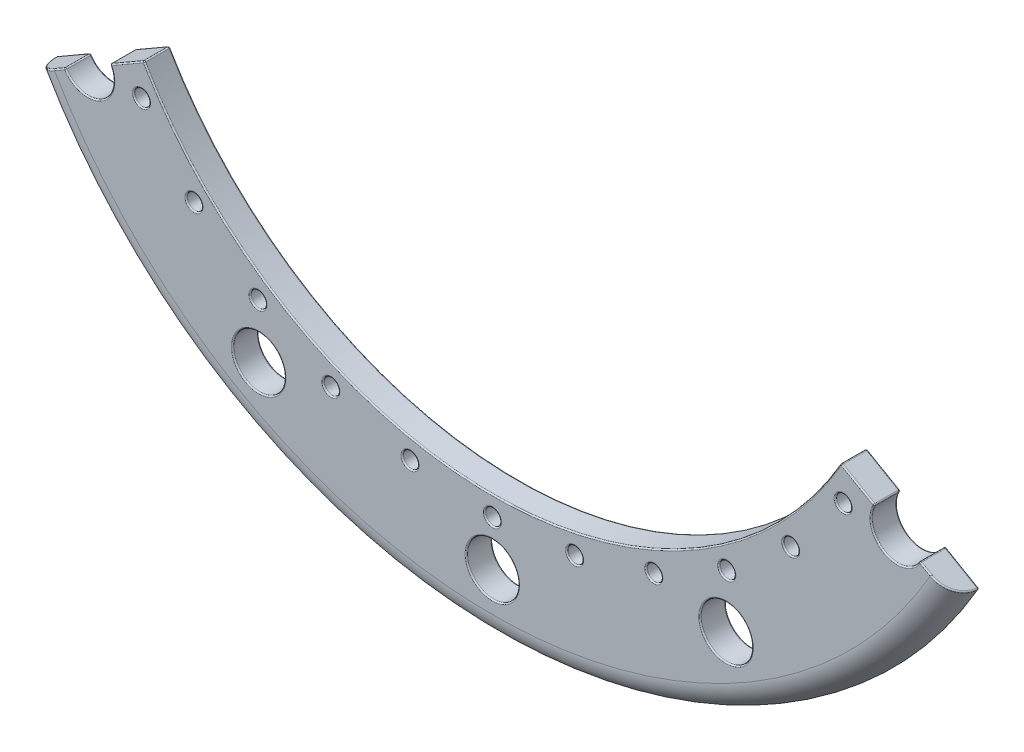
SolidWorks part; units mm, degrees
ref_plane "Спереди" through (0, 0, 0) normal (0, 0, 1) x (1, 0, 0)
ref_plane "Сверху" through (0, 0, 0) normal (0, 1, 0) x (1, 0, 0)
ref_plane "Справа" through (0, 0, 0) normal (1, 0, 0) x (0, 0, -1)
sketch "Эскиз1" plane through (0, 0, 0) normal (0, 0, 1) x (1, 0, 0)
  line L0 (0, 0) -> (0, -205) construction
  line L1 (0, 0) -> (147.2243, -85) construction
  line L2 (0, 0) -> (-147.2243, -85) construction
  line L3 (-177.5352, -102.5) -> (-164.5448, -95)
  line L4 (177.5352, -102.5) -> (164.5448, -95)
  line L5 (-90, -155.8846) -> (0, 0) construction
  line L6 (0, 0) -> (90, -155.8846) construction
  line L7 (-147.2243, -85) -> (-134.2339, -77.5)
  line L8 (-164.5448, -95) -> (-177.5352, -102.5) construction
  line L9 (164.5448, -95) -> (177.5352, -102.5) construction
  line L10 (147.2243, -85) -> (134.2339, -77.5)
  line L11 (0, -170) -> (0, -155) construction
  line L12 (0, 0) -> (0, -162.5) construction
  line L13 (0, 0) -> (-31.7022, -159.3776) construction
  line L14 (0, 0) -> (0, -162.5) construction
  line L15 (0, 0) -> (31.7022, -159.3776) construction
  arc A0 (-177.5352, -102.5) -> (177.5352, -102.5) centre (0, 0) ccw
  arc A1 (-134.2339, -77.5) -> (134.2339, -77.5) centre (0, 0) ccw
  arc A2 (-155.8846, -90) -> (155.8846, -90) centre (0, 0) ccw construction
  circle A3 centre (0, 0) radius 205 construction
  circle A4 centre (0, 0) radius 180 construction
  circle A5 centre (0, 0) radius 155 construction
  circle A6 centre (0, -180) radius 10
  circle A7 centre (0, 0) radius 162.5 construction
  circle A8 centre (90, -155.8846) radius 10
  arc A9 (147.2243, -85) -> (164.5448, -95) centre (155.8846, -90) ccw
  circle A10 centre (-90, -155.8846) radius 10
  circle A11 centre (0, -162.5) radius 3
  arc A12 (-164.5448, -95) -> (-147.2243, -85) centre (-155.8846, -90) ccw
  circle A13 centre (-31.7022, -159.3776) radius 3
  circle A14 centre (-62.1861, -150.1304) radius 3
  circle A15 centre (-90.2802, -135.1138) radius 3
  circle A16 centre (-114.9049, -114.9049) radius 3
  circle A17 centre (-135.1138, -90.2802) radius 3
  circle A18 centre (31.7022, -159.3776) radius 3
  circle A19 centre (62.1861, -150.1304) radius 3
  circle A20 centre (90.2802, -135.1138) radius 3
  circle A21 centre (114.9049, -114.9049) radius 3
  circle A22 centre (135.1138, -90.2802) radius 3
  point P26 (0, -162.5)
  dimension "D1" = 410
  dimension "D6" = 20
  dimension "D4" = 6
  dimension "D5" = 120
  dimension "D7" = 30
  dimension "D8" = 30
  dimension "D10" = 11.25
  dimension "D12" = 11.25
  dimension "D13" = 22.5
  dimension "D14" = 11.25
  dimension "D2" = 50
  dimension "D3" = 25
  dimension "D9" = 6
  dimension "D11" = 6
extrude "Бобышка-Вытянуть1" add sketch "Эскиз1" along normal mid plane 10
fillet "Скругление1" radius 10 1 edges at (0, -205, 5)
fillet "Скругление2" radius 0.5 51 edges at (140.7291, -81.25, 5) (134.2339, -77.5, 0) (140.7291, -81.25, -5) (171.04, -98.75, -5) (174.9987, -101.0355, 2.0711) (166.7099, -96.25, 5) (-134.2339, -77.5, 0) (-140.7291, -81.25, 5) (-140.7291, -81.25, -5) (-166.7099, -96.25, 5) (-174.9987, -101.0355, 2.0711) (-171.04, -98.75, -5) (-132.1138, -90.2802, -5) (-132.1138, -90.2802, 5) (-111.9049, -114.9049, -5) (-111.9049, -114.9049, 5) (-87.2802, -135.1138, -5) (-87.2802, -135.1138, 5) (-59.1861, -150.1304, -5) (-59.1861, -150.1304, 5) (-28.7022, -159.3776, -5) (-28.7022, -159.3776, 5) (3, -162.5, -5) (3, -162.5, 5) (34.7022, -159.3776, -5) (34.7022, -159.3776, 5) (65.1861, -150.1304, -5) (65.1861, -150.1304, 5) (93.2802, -135.1138, -5) (93.2802, -135.1138, 5) (117.9049, -114.9049, -5) (117.9049, -114.9049, 5) (138.1138, -90.2802, -5) (138.1138, -90.2802, 5) (164.5448, -95, 0) (150.8846, -98.6603, 5) (147.2243, -85, 0) (150.8846, -98.6603, -5) (100, -155.8846, -5) (100, -155.8846, 5) (10, -180, -5) (10, -180, 5) (-80, -155.8846, -5) (-80, -155.8846, 5) (-147.2243, -85, 0) (-150.8846, -98.6603, 5) (-164.5448, -95, 0) (-150.8846, -98.6603, -5) (0, -205, -5) (0, -155, -5) (0, -155, 5)
